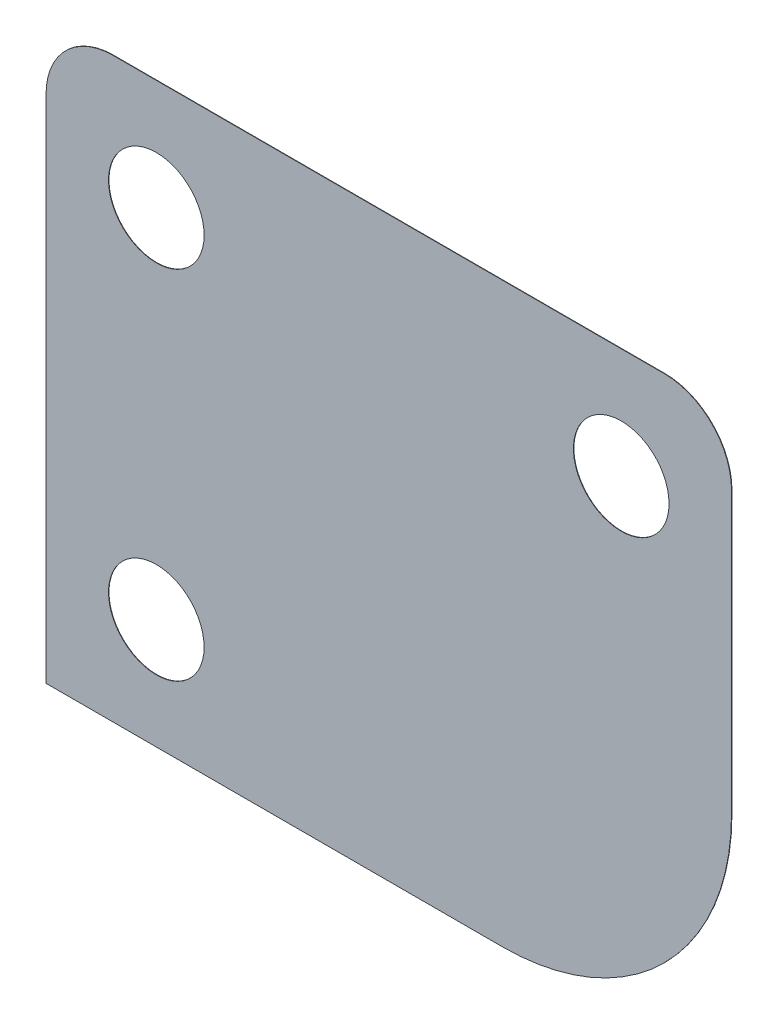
SolidWorks part; units mm, degrees
ref_plane "Front" through (0, 0, 0) normal (0, 0, 1) x (1, 0, 0)
ref_plane "Top" through (0, 0, 0) normal (0, 1, 0) x (1, 0, 0)
ref_plane "Right" through (0, 0, 0) normal (1, 0, 0) x (0, 0, -1)
sketch "Sketch1" plane through (0, 0, 0) normal (0, 0, 1) x (1, 0, 0)
  line L8 (-504.5642, -26.6178) -> (-504.5642, -10.1078)
  line L9 (-544.8232, -40.0798) -> (-518.0262, -40.0798)
  line L10 (-544.8232, -10.1078) -> (-544.8232, -40.0798)
  line L11 (-508.5012, -6.1708) -> (-540.8862, -6.1708)
  line L12 (-504.5642, -26.6178) -> (-504.5642, -10.1078)
  line L13 (-544.8232, -40.0798) -> (-518.0262, -40.0798)
  line L14 (-544.8232, -10.1078) -> (-544.8232, -40.0798)
  line L15 (-508.5012, -6.1708) -> (-540.8862, -6.1708)
  arc A6 (-518.0262, -40.0798) -> (-504.5642, -26.6178) centre (-518.0262, -26.6178) ccw
  arc A7 (-540.8862, -6.1708) -> (-544.8232, -10.1078) centre (-540.8862, -10.1078) ccw
  arc A8 (-504.5642, -10.1078) -> (-508.5012, -6.1708) centre (-508.5012, -10.1078) ccw
  arc A9 (-518.0262, -40.0798) -> (-504.5642, -26.6178) centre (-518.0262, -26.6178) ccw
  arc A10 (-540.8862, -6.1708) -> (-544.8232, -10.1078) centre (-540.8862, -10.1078) ccw
  arc A11 (-504.5642, -10.1078) -> (-508.5012, -6.1708) centre (-508.5012, -10.1078) ccw
  dimension "D1" = 0.508
extrude "Boss-Extrude1" add sketch "Sketch1" along normal blind 0.0254 separate body
hole_wizard "Hole1" positions "Point_Sketch" profile "Profil_Sketch" hole size "Ø0.15" standard "ISO"
sketch "Point_Sketch" plane through (-542.0004, -2.0467, 0.0254) normal (0, 0, -1) x (1, 0, 0)
  point P0 (3.6543, 10.6011)
  point P2 (3.6543, 31.5561)
  point P4 (30.9593, 10.6011)
sketch "Profil_Sketch" plane through (-538.3462, -12.6478, 0.0254) normal (1, 0, 0) x (0, -1, 0)
  line L0 (0, 0) -> (0, 0.0254)
  line L1 (0, 0.0254) -> (2.8067, 0.0254)
  line L2 (2.8067, 0.0254) -> (2.8067, 0)
  line L5 (2.8067, 0) -> (0, 0)
  line L11 (0, -6.35) -> (0, 107.95) construction
  dimension "Diameter" = 5.6134
  dimension "Thru Hole Depth" = 0.0254
other "usin_DL090_10-24x1.75-SHCS<1>"
